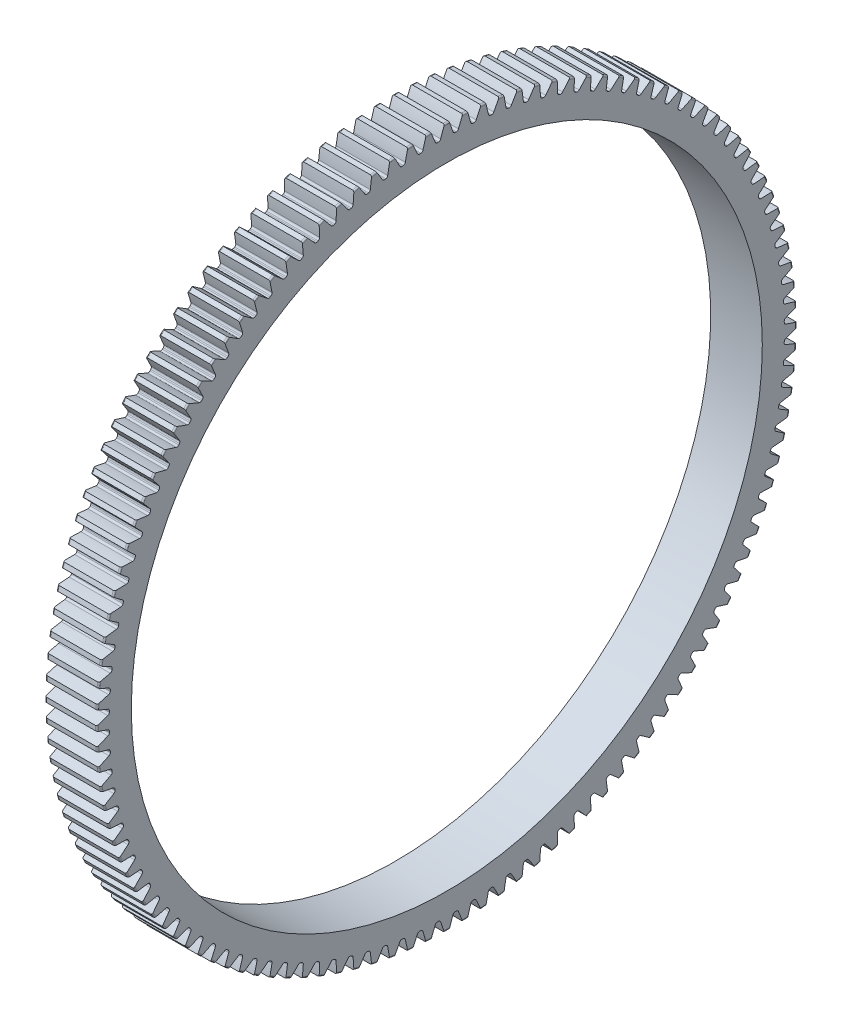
SolidWorks part; units mm, degrees
ref_plane "Front Plane" through (0, 0, 0) normal (0, 0, 1) x (1, 0, 0)
ref_plane "Top Plane" through (0, 0, 0) normal (0, 1, 0) x (1, 0, 0)
ref_plane "Right Plane" through (0, 0, 0) normal (1, 0, 0) x (0, 0, -1)
imported_body "Imported1"
sketch "Sketch1" plane through (-4.5, 0, 0) normal (-1, 0, 0) x (0, 0, 1)
  circle A0 centre (0, 0) radius 55
  dimension "D1" = 110
extrude "Cut-Extrude1" cut sketch "Sketch1" against normal through all
